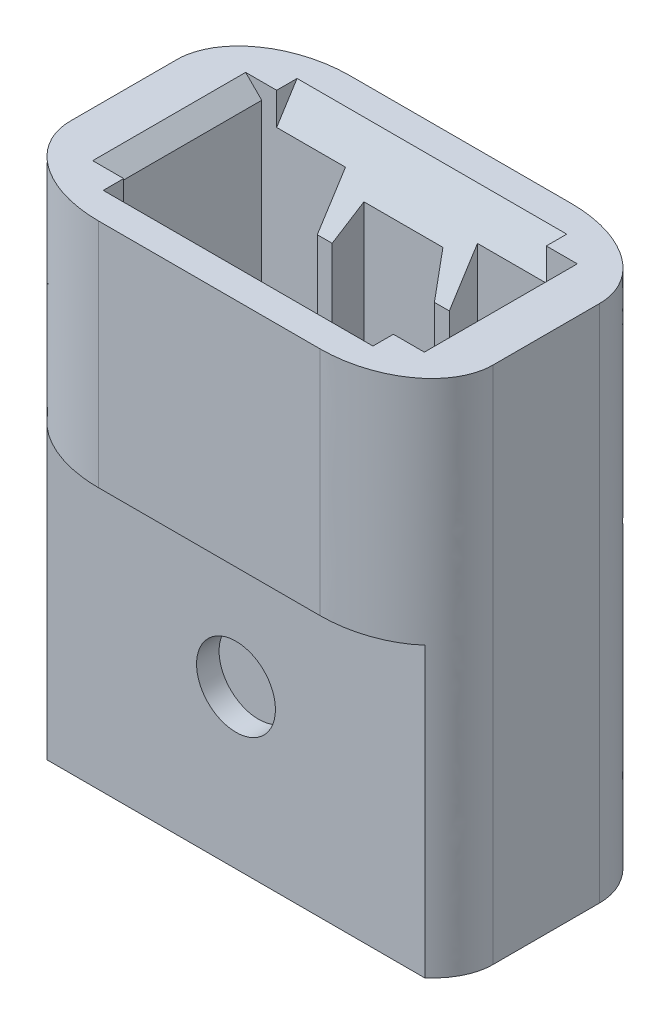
SolidWorks part; units mm, degrees
ref_plane "Front Plane" through (0, 0, 0) normal (0, 0, 1) x (1, 0, 0)
ref_plane "Top Plane" through (0, 0, 0) normal (0, 1, 0) x (1, 0, 0)
ref_plane "Right Plane" through (0, 0, 0) normal (1, 0, 0) x (0, 0, -1)
sketch "Sketch1" plane through (0, 0, 0) normal (0, 1, 0) x (1, 0, 0)
  line L0 (0, 0) -> (0, 60.9976) construction
  line L1 (-6.6675, -3.9688) -> (6.6675, -3.9688) construction
  line L2 (-6.6675, -3.9688) -> (-6.6675, 3.9687) construction
  line L3 (-6.6675, 3.9687) -> (6.6675, 3.9687) construction
  line L4 (6.6675, -3.9688) -> (6.6675, 3.9687) construction
  line L5 (-6.6675, -3.9688) -> (6.6675, 3.9687) construction
  line L6 (-6.6675, 3.9687) -> (6.6675, -3.9688) construction
  line L7 (0, 0) -> (-119.2814, 0) construction
  line L8 (-6.6675, 1.6827) -> (-0.3175, 1.6827) construction
  line L9 (-6.6675, 1.6827) -> (-6.6675, -1.6828)
  line L10 (-3.4925, 3.9687) -> (3.4925, 3.9687)
  line L11 (6.6675, 1.6827) -> (6.6675, -1.6828)
  line L12 (3.4925, -3.9688) -> (-3.4925, -3.9688)
  ellipse E0 centre (-3.4925, 1.6827) end of major axis (-0.3175, 1.6827) minor radius 2.286 (-3.4925, 3.9687) -> (-6.6675, 1.6827) ccw
  ellipse E1 centre (3.4925, 1.6827) end of major axis (0.3175, 1.6827) minor radius 2.286 (3.4925, 3.9687) -> (6.6675, 1.6827) cw
  ellipse E2 centre (3.4925, -1.6828) end of major axis (0.3175, -1.6828) minor radius 2.286 (3.4925, -3.9688) -> (6.6675, -1.6828) ccw
  ellipse E3 centre (-3.4925, -1.6828) end of major axis (-6.6675, -1.6828) minor radius 2.286 (-3.4925, -3.9688) -> (-6.6675, -1.6828) cw
  point P0 (0, 0)
  dimension "D1" = 3.175
  dimension "D2" = 2.286
  dimension "D3" = 13.335
  dimension "D4" = 7.9375
extrude "Boss-Extrude1" add sketch "Sketch1" against normal blind 16.383
sketch "Sketch2" plane through (0, 0, 3.9688) normal (0, 0, 1) x (1, 0, 0)
  line L0 (0, 0) -> (0, -24.5307) construction
  line L1 (-3.4925, 0) -> (3.4925, 0) construction
  line L2 (-3.4925, -16.383) -> (3.4925, -16.383) construction
  circle A0 centre (0, -11.4046) radius 1.2446
  dimension "D1" = 2.4892
  dimension "D2" = 4.9784
extrude "Cut-Extrude1" cut sketch "Sketch2" against normal through all
sketch "Sketch3" plane through (0, -16.383, 0) normal (0, -1, 0) x (1, 0, 0)
  line L0 (0, 0) -> (17.4435, 0) construction
  line L1 (-8.9071, -3.1242) -> (13.6114, -3.1242)
  line L2 (-8.9071, -3.1242) -> (-8.9071, -9.6347)
  line L3 (-8.9071, -9.6347) -> (13.6114, -9.6347)
  line L4 (13.6114, -9.6347) -> (13.6114, -3.1242)
  dimension "D1" = 6.2484
extrude "Cut-Extrude2" cut sketch "Sketch3" against normal blind 9.0932
mirror "Mirror1" about plane through (0, 0, 0) normal (0, 0, 1) of "Cut-Extrude2"
sketch "Sketch4" plane through (0, 0, 0) normal (0, 1, 0) x (1, 0, 0)
  line L1 (-4.7244, -2.413) -> (4.7244, -2.413)
  line L2 (-4.7244, -2.413) -> (-4.7244, 2.413)
  line L3 (-4.7244, 2.413) -> (4.7244, 2.413)
  line L4 (4.7244, -2.413) -> (4.7244, 2.413)
  line L5 (-4.7244, -2.413) -> (4.7244, 2.413) construction
  line L6 (-4.7244, 2.413) -> (4.7244, -2.413) construction
  point P0 (0, 0)
  dimension "D1" = 9.4488
  dimension "D2" = 4.826
extrude "Cut-Extrude3" cut sketch "Sketch4" against normal through all
sketch "Sketch5" plane through (0, 0, 0) normal (0, 1, 0) x (1, 0, 0)
  line L0 (4.7244, 2.413) -> (-4.7244, 2.413) construction
  line L1 (2.0828, -2.413) -> (-2.0828, -2.413)
  line L2 (2.0828, -2.413) -> (2.0828, 2.413)
  line L3 (2.0828, 2.413) -> (-2.0828, 2.413)
  line L4 (-2.0828, -2.413) -> (-2.0828, 2.413)
  line L5 (2.0828, -2.413) -> (-2.0828, 2.413) construction
  line L6 (2.0828, 2.413) -> (-2.0828, -2.413) construction
  point P0 (0, 0)
  dimension "D1" = 4.1656
extrude "Boss-Extrude3" add sketch "Sketch5" against normal through all
sketch "Sketch6" plane through (0, 0, 0) normal (0, 1, 0) x (1, 0, 0)
  line L0 (4.7244, 2.413) -> (2.0828, 2.413) construction
  line L1 (2.493, 0) -> (1.2465, 2.159)
  line L2 (1.2465, 2.159) -> (-1.2465, 2.159)
  line L3 (-1.2465, 2.159) -> (-2.493, 0)
  line L4 (-2.493, 0) -> (-1.2465, -2.159)
  line L5 (-1.2465, -2.159) -> (1.2465, -2.159)
  line L6 (1.2465, -2.159) -> (2.493, 0)
  circle A0 centre (0, 0) radius 2.159 construction
  dimension "D1" = 0.254
extrude "Cut-Extrude4" cut sketch "Sketch6" against normal blind 9.525
sketch "Sketch7" plane through (0, 0, 0) normal (0, 1, 0) x (1, 0, 0)
  line L1 (-3.1561, -1.524) -> (3.1561, -1.524)
  line L2 (-3.1561, -1.524) -> (-3.1561, 1.524)
  line L3 (-3.1561, 1.524) -> (3.1561, 1.524)
  line L4 (3.1561, -1.524) -> (3.1561, 1.524)
  line L5 (-3.1561, -1.524) -> (3.1561, 1.524) construction
  line L6 (-3.1561, 1.524) -> (3.1561, -1.524) construction
  point P0 (0, 0)
  dimension "D1" = 3.048
extrude "Cut-Extrude5" cut sketch "Sketch7" against normal blind 9.525
chamfer "Chamfer1" distance 0.508 angle 45 2 edges at (4.7244, 0, 0) (-4.7244, 0, 0)
sketch "Sketch8" plane through (0, 0, 0) normal (1, 0, 0) x (0, 0, -1)
  line L0 (0, 0) -> (0, 4.668) construction
  line L1 (3.9687, 0) -> (1.6827, 0) construction
  line L2 (3.0581, 0) -> (1.1232, 0)
  line L3 (3.0581, 0) -> (1.1232, -3.0487)
  line L4 (1.1232, -3.0487) -> (1.1232, 0)
  dimension "D1" = 1.1232
  dimension "D2" = 1.9349
  dimension "D3" = 3.0487
extrude "Cut-Extrude6" cut sketch "Sketch8" against normal blind 4.2545 and the other way blind 4.2545
mirror "Mirror2" about plane through (0, 0, 0) normal (0, 0, 1) of "Cut-Extrude6"
